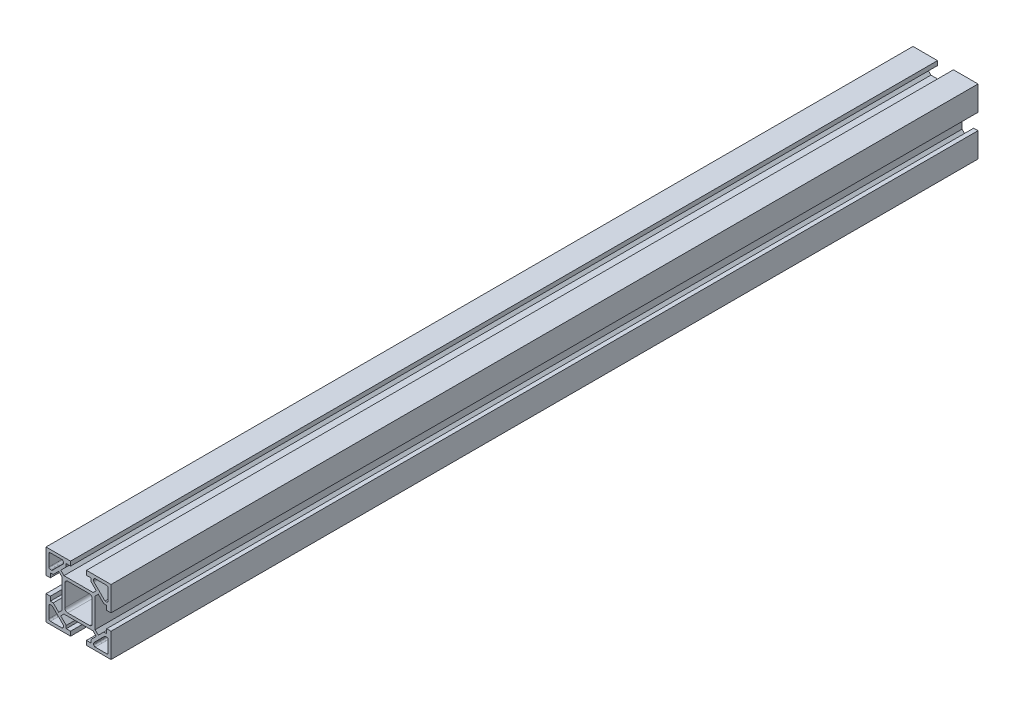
SolidWorks part; units mm, degrees
ref_plane "Face" through (0, 0, 0) normal (0, 0, 1) x (1, 0, 0)
ref_plane "Dessus" through (0, 0, 0) normal (0, 1, 0) x (1, 0, 0)
ref_plane "Droite" through (0, 0, 0) normal (1, 0, 0) x (0, 0, -1)
sketch "Esquisse1" plane through (0, 0, 0) normal (0, 0, 1) x (1, 0, 0)
  line L0 (-112.9997, 0) -> (109.1853, 0) construction
  line L1 (0, -66.2741) -> (0, 93.4512) construction
  line L2 (-5.5, 45) -> (-5.5, 42)
  line L3 (-22.5, 45) -> (-5.5, 45)
  line L4 (-22.5, 45) -> (-22.5, 28)
  line L5 (5.5, 0) -> (5.5, 3)
  line L6 (22.5, 0) -> (5.5, 0)
  line L7 (-5.5, 42) -> (-8.5, 42)
  line L8 (-8.5, 42) -> (-8.5, 40)
  line L9 (-8.5, 40) -> (-12.2929, 36.2071)
  line L10 (-18.3284, 33) -> (-10.5, 40.8284)
  line L11 (-10.0858, 34) -> (10.0858, 34)
  line L12 (-34.5899, 22.5) -> (23.1177, 22.5) construction
  line L13 (-22.5, 28) -> (-19.5, 28)
  line L14 (-19.5, 28) -> (-19.5, 31)
  line L15 (-19.5, 31) -> (-17.5, 31)
  line L16 (-17.5, 31) -> (-13.7071, 34.7929)
  line L17 (-20.5, 33) -> (-18.3284, 33)
  line L18 (-11.5, 32.5858) -> (-11.5, 12.4142)
  line L19 (22.5, 0) -> (22.5, 17)
  line L20 (-9.5, 32) -> (-9.5, 13)
  line L21 (-9.5, 32) -> (0, 32)
  line L22 (5.5, 3) -> (8.5, 3)
  line L23 (-20.5, 43) -> (-20.5, 33)
  line L24 (-20.5, 43) -> (-10.5, 43)
  line L25 (-10.5, 43) -> (-10.5, 40.8284)
  line L26 (8.5, 3) -> (8.5, 5)
  line L27 (-13.7071, 34.7929) -> (-11.5, 32.5858)
  line L28 (-12.2929, 36.2071) -> (-10.0858, 34)
  line L29 (8.5, 5) -> (12.2929, 8.7929)
  line L30 (18.3284, 12) -> (10.5, 4.1716)
  line L31 (22.5, 17) -> (19.5, 17)
  line L32 (19.5, 17) -> (19.5, 14)
  line L33 (19.5, 14) -> (17.5, 14)
  line L34 (17.5, 14) -> (13.7071, 10.2071)
  line L35 (20.5, 12) -> (18.3284, 12)
  line L36 (9.5, 13) -> (0, 13)
  line L37 (20.5, 2) -> (20.5, 12)
  line L38 (20.5, 2) -> (10.5, 2)
  line L39 (10.5, 2) -> (10.5, 4.1716)
  line L40 (13.7071, 10.2071) -> (11.5, 12.4142)
  line L41 (12.2929, 8.7929) -> (10.0858, 11)
  line L42 (-12.2929, 8.7929) -> (-10.0858, 11)
  line L43 (-13.7071, 10.2071) -> (-11.5, 12.4142)
  line L44 (-10.5, 2) -> (-10.5, 4.1716)
  line L45 (12.2929, 36.2071) -> (10.0858, 34)
  line L46 (13.7071, 34.7929) -> (11.5, 32.5858)
  line L47 (-20.5, 2) -> (-10.5, 2)
  line L48 (10.5, 43) -> (10.5, 40.8284)
  line L49 (20.5, 43) -> (10.5, 43)
  line L50 (20.5, 43) -> (20.5, 33)
  line L51 (-20.5, 2) -> (-20.5, 12)
  line L52 (9.5, 32) -> (0, 32)
  line L53 (9.5, 32) -> (9.5, 13)
  line L54 (-9.5, 13) -> (0, 13)
  line L55 (11.5, 32.5858) -> (11.5, 12.4142)
  line L56 (20.5, 33) -> (18.3284, 33)
  line L57 (17.5, 31) -> (13.7071, 34.7929)
  line L58 (19.5, 31) -> (17.5, 31)
  line L59 (19.5, 28) -> (19.5, 31)
  line L60 (22.5, 28) -> (19.5, 28)
  line L61 (18.3284, 33) -> (10.5, 40.8284)
  line L62 (8.5, 40) -> (12.2929, 36.2071)
  line L63 (8.5, 42) -> (8.5, 40)
  line L64 (5.5, 42) -> (8.5, 42)
  line L65 (-20.5, 12) -> (-18.3284, 12)
  line L66 (-17.5, 14) -> (-13.7071, 10.2071)
  line L67 (22.5, 45) -> (22.5, 28)
  line L68 (22.5, 45) -> (5.5, 45)
  line L69 (5.5, 45) -> (5.5, 42)
  line L70 (-19.5, 14) -> (-17.5, 14)
  line L71 (-19.5, 17) -> (-19.5, 14)
  line L72 (-22.5, 17) -> (-19.5, 17)
  line L73 (-10.0858, 11) -> (10.0858, 11)
  line L74 (-18.3284, 12) -> (-10.5, 4.1716)
  line L75 (-8.5, 5) -> (-12.2929, 8.7929)
  line L76 (-8.5, 3) -> (-8.5, 5)
  line L77 (-5.5, 3) -> (-8.5, 3)
  line L78 (-22.5, 0) -> (-22.5, 17)
  line L79 (-22.5, 0) -> (-5.5, 0)
  line L80 (-5.5, 0) -> (-5.5, 3)
  point P7 (-11.5, 22.5)
  point P27 (-11.5, 22.5)
  point P47 (11.5, 22.5)
  point P48 (9.5, 22.5)
  point P74 (0, 34)
  point P81 (-9.5, 22.5)
  point P91 (0, 11)
  dimension "D1" = 3
  dimension "D3" = 45
  dimension "D4" = 22.5
  dimension "D5" = 11
  dimension "D6" = 2
  dimension "D7" = 2
  dimension "D8" = 2
  dimension "D9" = 8.5
  dimension "D10" = 5.5
  dimension "D11" = 22.5
  dimension "D12" = 3
  dimension "D13" = 2
  dimension "D14" = 8.5
  dimension "D15" = 45
  dimension "D16" = 11
  dimension "D17" = 5.5
  dimension "D21" = 2
extrude "Extrusion1" add sketch "Esquisse1" along normal blind 600
fillet "Congé1" radius 1
fillet "Congé2" radius 2
sketch "Esquisse2" plane through (0, 0, 0) normal (0, -1, 0) x (1, 0, 0)
  circle A0 centre (0, 377) radius 5.5
  circle A1 centre (0, 333) radius 5.5
  arc A2 (-3.375, 381.9608) -> (3.375, 381.9608) centre (0, 377) ccw construction
  arc A3 (3.375, 328.0392) -> (-3.375, 328.0392) centre (0, 333) ccw construction
  dimension "D1" = 11
extrude "Enlèv. mat.-Extru.1" cut sketch "Esquisse2" against normal through all
